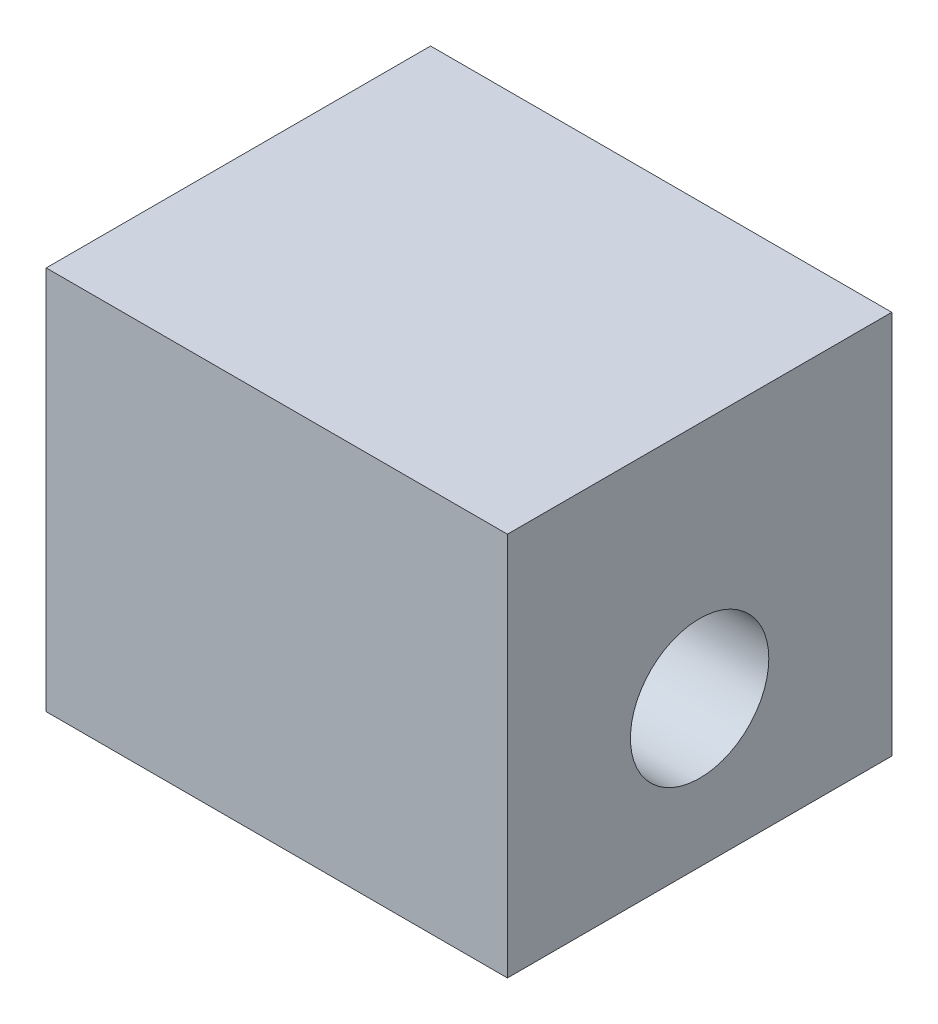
SolidWorks part; units mm, degrees
ref_plane "Спереди" through (0, 0, 0) normal (0, 0, 1) x (1, 0, 0)
ref_plane "Сверху" through (0, 0, 0) normal (0, 1, 0) x (1, 0, 0)
ref_plane "Справа" through (0, 0, 0) normal (1, 0, 0) x (0, 0, -1)
other "Configuration Table"
sketch "Эскиз1" plane through (0, 0, 0) normal (0, 1, 0) x (1, 0, 0)
  line L1 (-18.0296, 2.8079) -> (-6.0296, 2.8079)
  line L2 (-18.0296, 2.8079) -> (-18.0296, -7.1921)
  line L3 (-18.0296, -7.1921) -> (-6.0296, -7.1921)
  line L4 (-6.0296, 2.8079) -> (-6.0296, -7.1921)
  dimension "D1" = 12
  dimension "D2" = 10
extrude "Бобышка-Вытянуть1" add sketch "Эскиз1" along normal blind 10
sketch "Эскиз2" plane through (-6.0296, 0, 0) normal (1, 0, 0) x (0, 0, -1)
  line L0 (-8.5463, 3.8) -> (5.2995, 3.8) construction
  line L1 (-2.1921, 10.5236) -> (-2.1921, -1.6487) construction
  line L4 (-7.1921, 0) -> (2.8079, 0)
  line L5 (2.8079, 0) -> (2.8079, 10)
  line L6 (2.8079, 10) -> (-7.1921, 10)
  line L7 (-7.1921, 10) -> (-7.1921, 0)
  line L8 (-7.1921, 0) -> (2.8079, 0)
  line L9 (2.8079, 0) -> (2.8079, 10)
  line L10 (2.8079, 10) -> (-7.1921, 10)
  line L11 (-7.1921, 10) -> (-7.1921, 0)
  circle A0 centre (-2.1921, 3.8) radius 1.8
  dimension "D5" = 3.6
  dimension "D2" = 10
  dimension "D3" = 5
  dimension "D4" = 3.8
  dimension "D1" = 0
extrude "Вырез-Вытянуть1" cut sketch "Эскиз2" against normal through all contours A0
